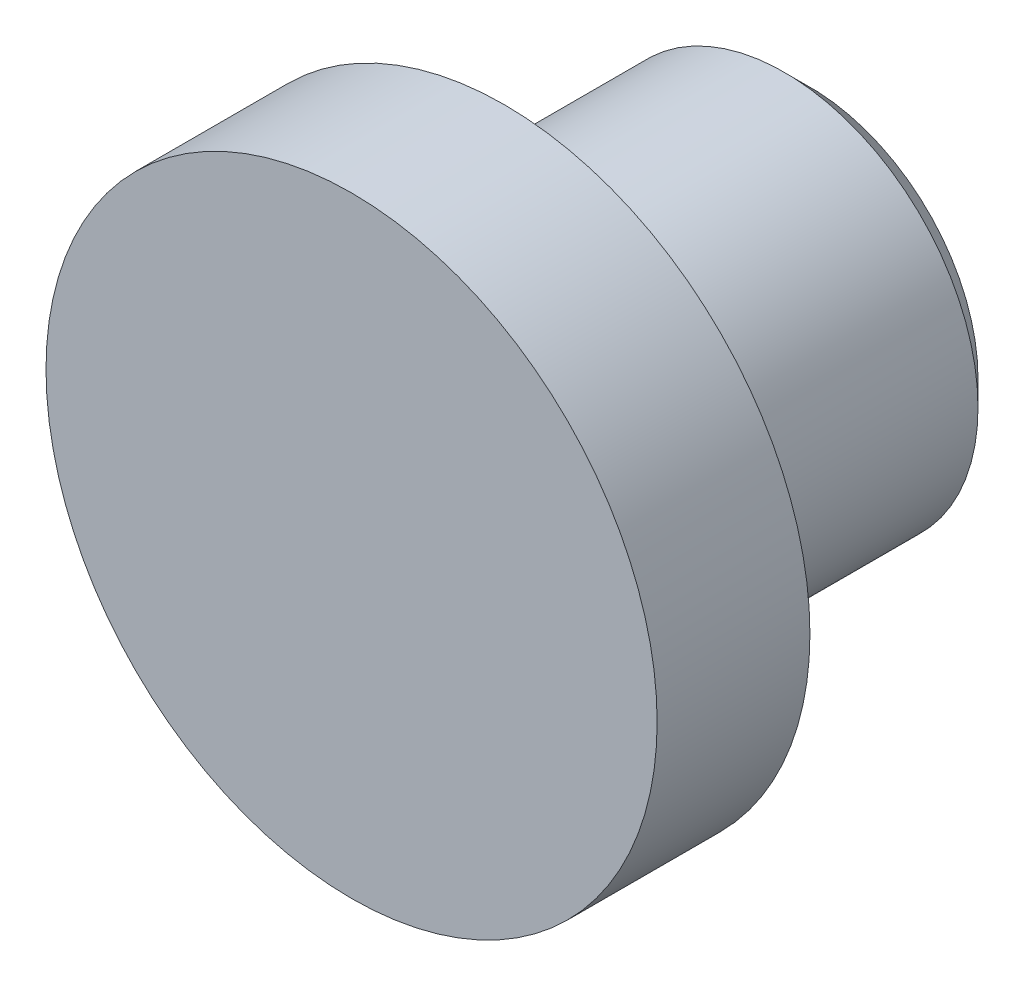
SolidWorks part; units mm, degrees
ref_plane "Plan de face" through (0, 0, 0) normal (0, 0, 1) x (1, 0, 0)
ref_plane "Plan de dessus" through (0, 0, 0) normal (0, 1, 0) x (1, 0, 0)
ref_plane "Plan de droite" through (0, 0, 0) normal (1, 0, 0) x (0, 0, -1)
sketch "Esquisse1" plane through (0, 0, 0) normal (0, 0, 1) x (1, 0, 0)
  circle A0 centre (0, 0) radius 3.8
  dimension "D1" = 7.6
extrude "Boss.-Extru.1" add sketch "Esquisse1" along normal blind 6
sketch "Esquisse2" plane through (0, 0, 6) normal (0, 0, 1) x (1, 0, 0)
  circle A0 centre (0, 0) radius 6
  dimension "D1" = 12
extrude "Boss.-Extru.2" add sketch "Esquisse2" along normal blind 3
chamfer "Chanfrein1" distance 0.5 angle 45 1 edges at (3.8, 0, 0)
